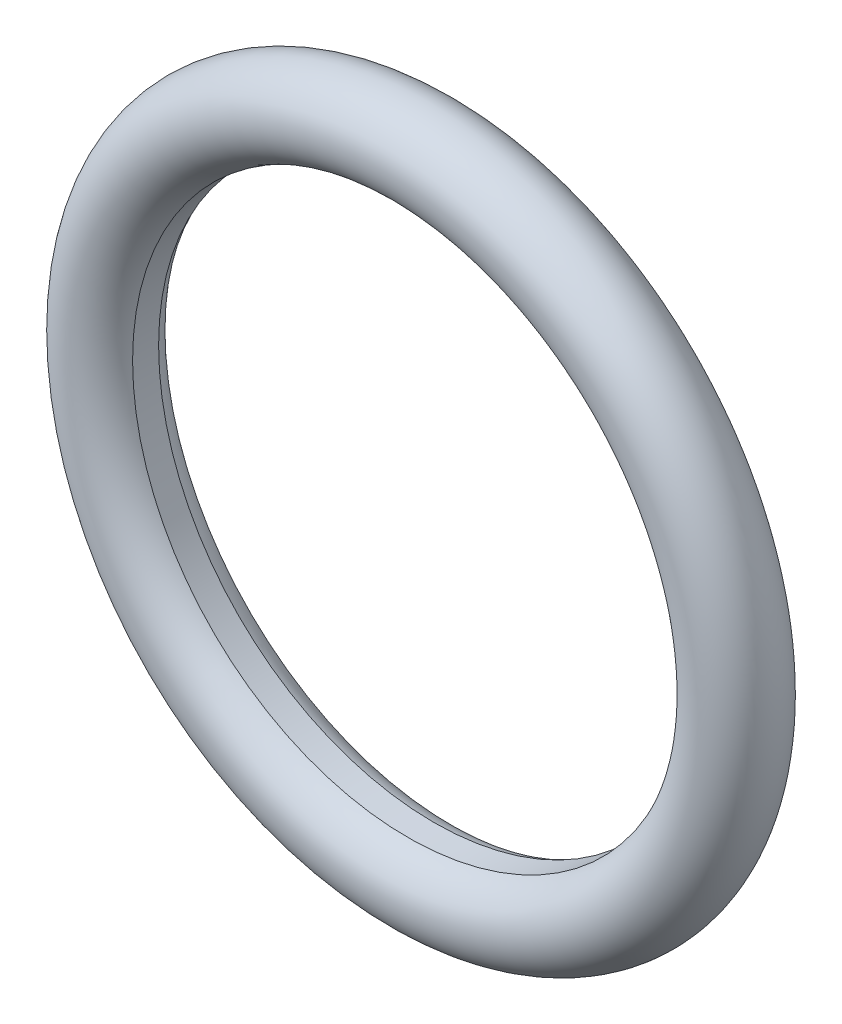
SolidWorks part; units mm, degrees
ref_plane "Front" through (0, 0, 0) normal (0, 0, 1) x (1, 0, 0)
ref_plane "Top" through (0, 0, 0) normal (0, 1, 0) x (1, 0, 0)
ref_plane "Right" through (0, 0, 0) normal (1, 0, 0) x (0, 0, -1)
sketch "Sketch1" plane through (0, 0, 0) normal (0, 0, 1) x (1, 0, 0)
  circle A0 centre (0, 0) radius 9.87
  dimension "D1" = 19.74
sketch "Sketch2" plane through (0, 0, 0) normal (1, 0, 0) x (0, 0, -1)
  line L0 (0, 9.87) -> (0, -9.87) construction
  circle A0 centre (0, 9.87) radius 1.31
  dimension "D1" = 2.62
  dimension "D2" = 9.87
sweep "Base-Sweep" add profiles "Sketch2" path "Sketch1"
sketch "Sketch3" plane through (0, 0, 0) normal (0, 0, 1) x (1, 0, 0)
  circle A0 centre (0, 0) radius 8.625
  dimension "D1" = 17.25
extrude "Cut-Extrude1" cut sketch "Sketch3" against normal through all and the other way through all
